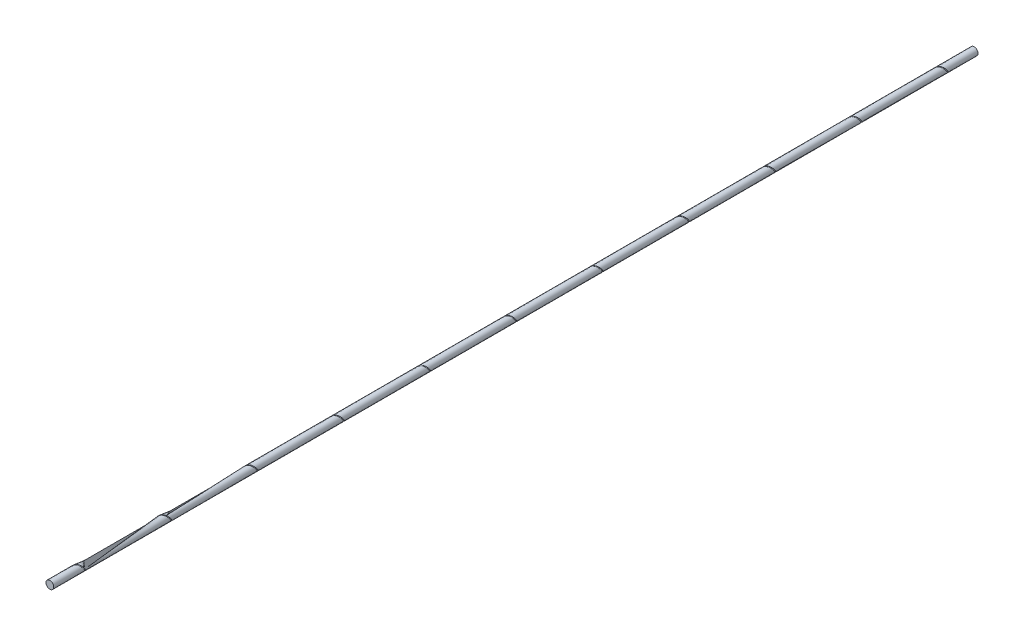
SolidWorks part; units mm, degrees
ref_plane "Front Plane" through (0, 0, 0) normal (0, 0, 1) x (1, 0, 0)
ref_plane "Top Plane" through (0, 0, 0) normal (0, 1, 0) x (1, 0, 0)
ref_plane "Right Plane" through (0, 0, 0) normal (1, 0, 0) x (0, 0, -1)
sketch "Sketch1" plane through (0, 0, 0) normal (0, 0, 1) x (1, 0, 0)
  circle A0 centre (0, 0) radius 25
  dimension "D1" = 50
extrude "Boss-Extrude1" add sketch "Sketch1" along normal blind 6000
ref_plane "Plane1" through (0, 0, 150) normal (0, 0, 1) x (1, 0, 0)
sketch "Sketch2" plane through (0, 0, 150) normal (0, 0, 1) x (1, 0, 0)
  circle A0 centre (0, 0) radius 27.646
  dimension "D1" = 55.292
curve "Helix/Spiral1"
sketch "Sketch3" plane through (0, 0, 0) normal (0, 1, 0) x (1, 0, 0)
  circle A0 centre (-27.646, -150) radius 3.969
  spline S0 degree 3 poles (-27.646, -150) (-27.646, -151.3307) (-27.0608, -154.0012) (-24.4828, -157.9997) (-20.3663, -162.0001) (-14.9702, -166) (-8.6335, -170) (-1.7543, -174) (5.2352, -178) (11.8957, -182) (17.8087, -186) (22.6028, -190) (25.9766, -194) (27.7183, -198) (27.7183, -202) (25.9766, -206) (22.6028, -210) (17.8087, -214) (11.8957, -218) (5.2352, -222) (-1.7543, -226) (-8.6335, -230) (-14.9702, -234) (-20.3663, -237.9999) (-24.4828, -242.0003) (-27.0608, -245.9988) (-27.646, -248.6693) (-27.646, -250) knots 0 0 0 0 0.04 0.08 0.12 0.16 0.2 0.24 0.28 0.32 0.36 0.4 0.44 0.48 0.52 0.56 0.6 0.64 0.68 0.72 0.76 0.8 0.84 0.88 0.92 0.96 1 1 1 1 construction
  dimension "D1" = 7.938
sweep "Cut-Sweep1" cut profiles "Sketch3" path "Helix/Spiral1"
pattern_linear "LPattern1" count 11 spacing 560 along (0, 0, -1) of "Cut-Sweep1"
